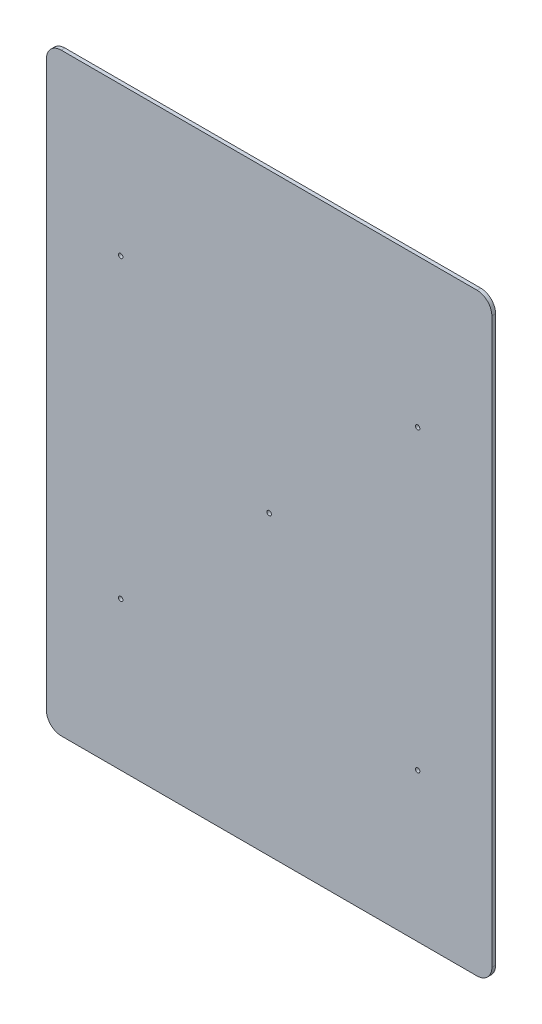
SolidWorks part; units mm, degrees
ref_plane "Plan de face" through (0, 0, 0) normal (0, 0, 1) x (1, 0, 0)
ref_plane "Plan de dessus" through (0, 0, 0) normal (0, 1, 0) x (1, 0, 0)
ref_plane "Plan de droite" through (0, 0, 0) normal (1, 0, 0) x (0, 0, -1)
sketch "Esquisse1" plane through (0, 0, 0) normal (0, 0, 1) x (1, 0, 0)
  line L1 (0, 0) -> (-600, 0)
  line L2 (0, 0) -> (0, -800)
  line L3 (0, -800) -> (-600, -800)
  line L4 (-600, 0) -> (-600, -800)
  dimension "D1" = 800
  dimension "D2" = 600
extrude "Boss.-Extru.1" add sketch "Esquisse1" along normal blind 5
fillet "Congé1" radius 20 4 edges at (0, -800, 2.5) (-600, -800, 2.5) (-600, 0, 2.5) (0, 0, 2.5)
sketch "Esquisse2" plane through (0, 0, 0) normal (0, 0, -1) x (-1, 0, 0)
  circle A0 centre (100, -600) radius 3
  circle A1 centre (300, -400) radius 3
  circle A2 centre (100, -200) radius 3
  circle A3 centre (500, -200) radius 3
  circle A4 centre (500, -600) radius 3
  dimension "D3" = 6
extrude "Enlèv. mat.-Extru.1" cut sketch "Esquisse2" against normal through all
